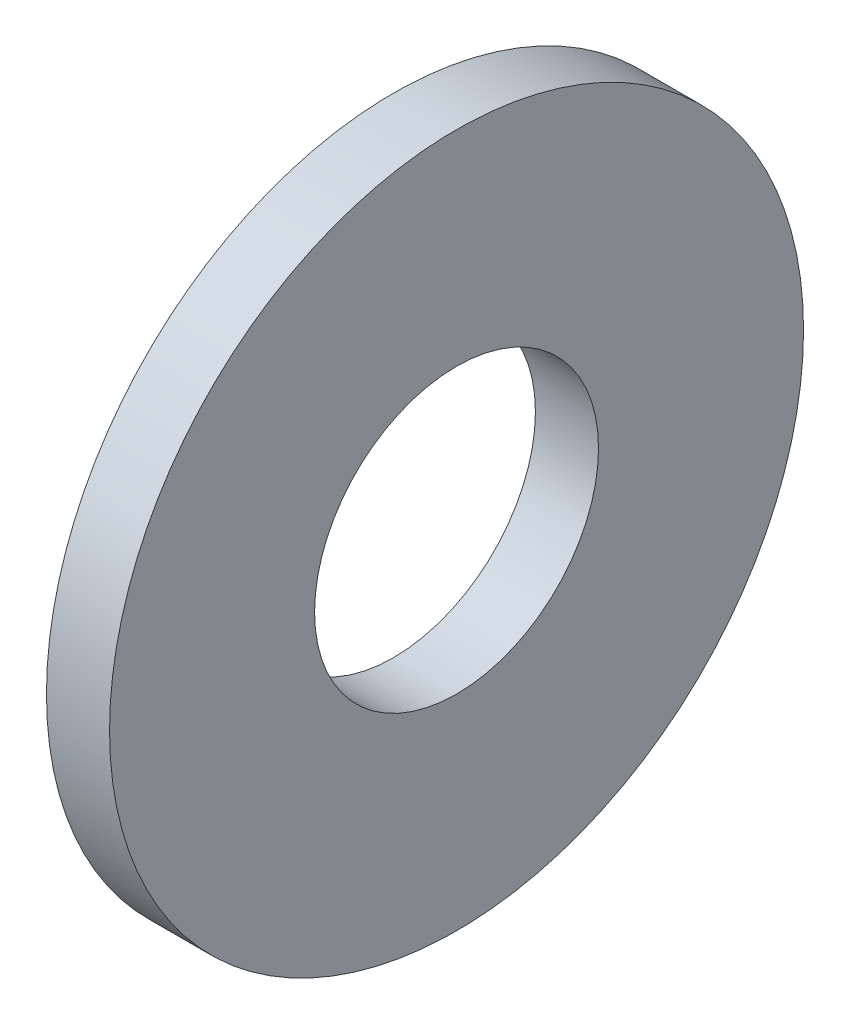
SolidWorks part; units mm, degrees
ref_plane "Plan de face" through (0, 0, 0) normal (0, 0, 1) x (1, 0, 0)
ref_plane "Plan de dessus" through (0, 0, 0) normal (0, 1, 0) x (1, 0, 0)
ref_plane "Plan de droite" through (0, 0, 0) normal (1, 0, 0) x (0, 0, -1)
sketch "Esquisse2" plane through (0, 0, 0) normal (0, 0, 1) x (1, 0, 0)
  line L0 (-7.4558, 0) -> (12.2905, 0) construction
  line L1 (1, 5.5) -> (1, 2.25)
  line L2 (1, 2.25) -> (0, 2.25)
  line L3 (0, 2.25) -> (0, 5.5)
  line L4 (0, 5.5) -> (1, 5.5)
  dimension "D1" = 2.25
  dimension "D2" = 5.5
  dimension "Thickness" = 1
revolve "Révolution1" add sketch "Esquisse2" angle 360 about L0
